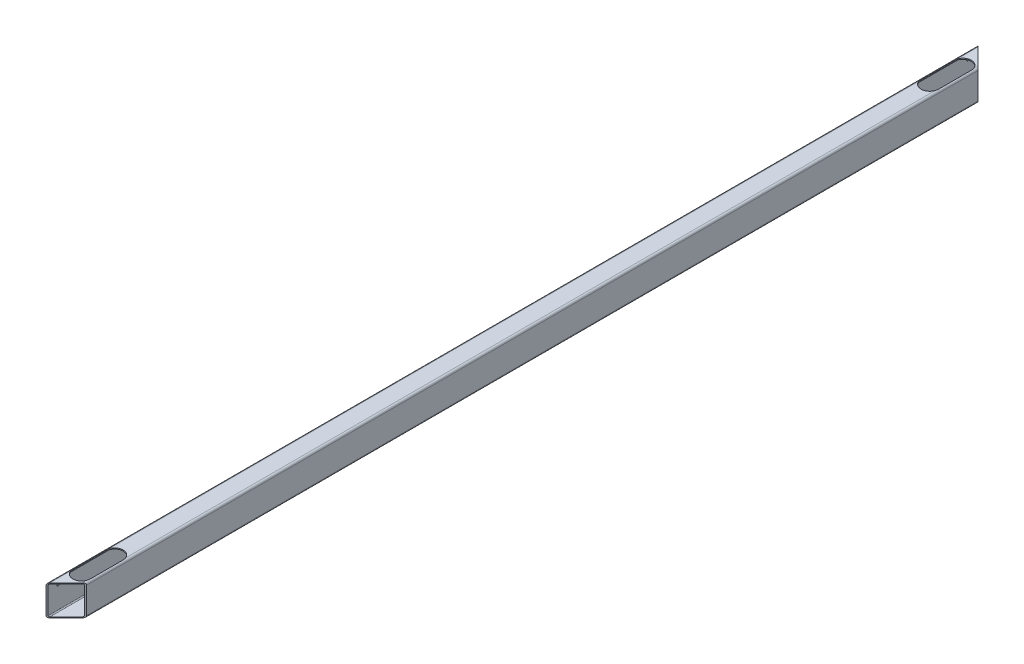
SolidWorks part; units mm, degrees
ref_plane "Plan1" through (0, 0, 0) normal (0, 0, 1) x (1, 0, 0)
ref_plane "Plan2" through (0, 0, 0) normal (0, 1, 0) x (1, 0, 0)
ref_plane "Plan3" through (0, 0, 0) normal (1, 0, 0) x (0, 0, -1)
sketch "Esquisse1" plane through (0, 0, 0) normal (0, 0, 1) x (1, 0, 0)
  line L0 (0, 12.1239) -> (0, -12.1239) construction
  line L1 (16, -30) -> (-16, -30)
  line L2 (20, -26) -> (20, 26)
  line L3 (16, 30) -> (-16, 30)
  line L4 (-20, -26) -> (-20, 26)
  line L5 (-5.9017, 0) -> (5.9017, 0) construction
  arc A0 (16, 30) -> (20, 26) centre (16, 26) cw
  arc A1 (-20, 26) -> (-16, 30) centre (-16, 26) cw
  arc A2 (-20, -26) -> (-16, -30) centre (-16, -26) ccw
  arc A3 (20, -26) -> (16, -30) centre (16, -26) cw
  point P7 (20, 30)
  point P10 (-20, 30)
  point P13 (-20, -30)
  dimension "D3" = 4
  dimension "D1" = 40
  dimension "D2" = 60
extrude "Base-Extru.-Mince" add sketch "Esquisse1" along normal mid plane 1836 thin
ref_plane "Plan4" through (449, 0, -449) normal (-0.7071, 0, 0.7071) x (0.7071, 0, 0.7071)
sketch "Esquisse4" plane through (0, 30, 0) normal (0, 1, 0) x (-1, 0, 0)
  line L0 (20, -918) -> (-20, -878)
  line L1 (20, -918) -> (-20, -918)
  line L2 (-20, -918) -> (-20, -878)
  line L3 (-413.6447, -484.3553) -> (-484.3553, -413.6447) construction
  line L4 (-20, 918) -> (-20, -918) construction
  line L5 (-16, -918) -> (16, -918) construction
extrude "Enlèv. mat.-Extru.3" cut sketch "Esquisse4" against normal blind 60
sketch "Esquisse5" plane through (0, 30, 0) normal (0, 1, 0) x (-1, 0, 0)
  line L0 (20, 918) -> (-20, 878)
  line L2 (-20, 918) -> (20, 918)
  line L4 (-20, 918) -> (-20, 878)
  line L6 (20, 918) -> (20, -918) construction
  line L7 (-16, 918) -> (16, 918) construction
  line L8 (-20, 918) -> (-20, -878) construction
extrude "Enlèv. mat.-Extru.4" cut sketch "Esquisse5" against normal blind 60
sketch "Esquisse6" plane through (0, 30, 0) normal (0, 1, 0) x (-1, 0, 0)
  line L0 (-20, 878) -> (-20, -878) construction
  line L1 (-17, -868) -> (-17, -803)
  line L2 (17, -803) -> (17, -868)
  line L4 (20, 918) -> (20, -918) construction
  line L6 (-17, 803) -> (-17, 868)
  line L7 (17, 803) -> (17, 868)
  arc A0 (-17, -868) -> (17, -868) centre (0, -868) ccw
  arc A1 (17, -803) -> (-17, -803) centre (0, -803) ccw
  arc A2 (17, 868) -> (-17, 868) centre (0, 868) ccw
  arc A3 (-17, 803) -> (17, 803) centre (0, 803) ccw
  dimension "D3" = 34
  dimension "D4" = 34
  dimension "D11" = 65
  dimension "D12" = 20
  dimension "D9" = 34
  dimension "D10" = 34
  dimension "D14" = 50
  dimension "D1" = 50
  dimension "D2" = 65
  dimension "D5" = 20
  dimension "D6" = 20
  dimension "D7" = 3
  dimension "D8" = 34
  dimension "D13" = 20
extrude "Enlèv. mat.-Extru.5" cut sketch "Esquisse6" against normal blind 2
sketch "Esquisse7" plane through (-20, 0, 0) normal (-1, 0, 0) x (0, 0, 1)
  line L0 (-918, 26) -> (-918, -26) construction
  line L1 (-873.7446, 30) -> (-914, 30) construction
  line L2 (0, 128.3514) -> (0, -128.3514) construction
  circle A0 centre (-896, 17) radius 2.5
  circle A1 centre (-826, -17) radius 2.5
  circle A2 centre (896, 17) radius 2.5
  circle A3 centre (826, -17) radius 2.5
  dimension "D1" = 5
  dimension "D2" = 22
  dimension "D4" = 13
  dimension "D3" = 70
  dimension "D5" = 34
extrude "Enlèv. mat.-Extru.6" cut sketch "Esquisse7" against normal up to next
